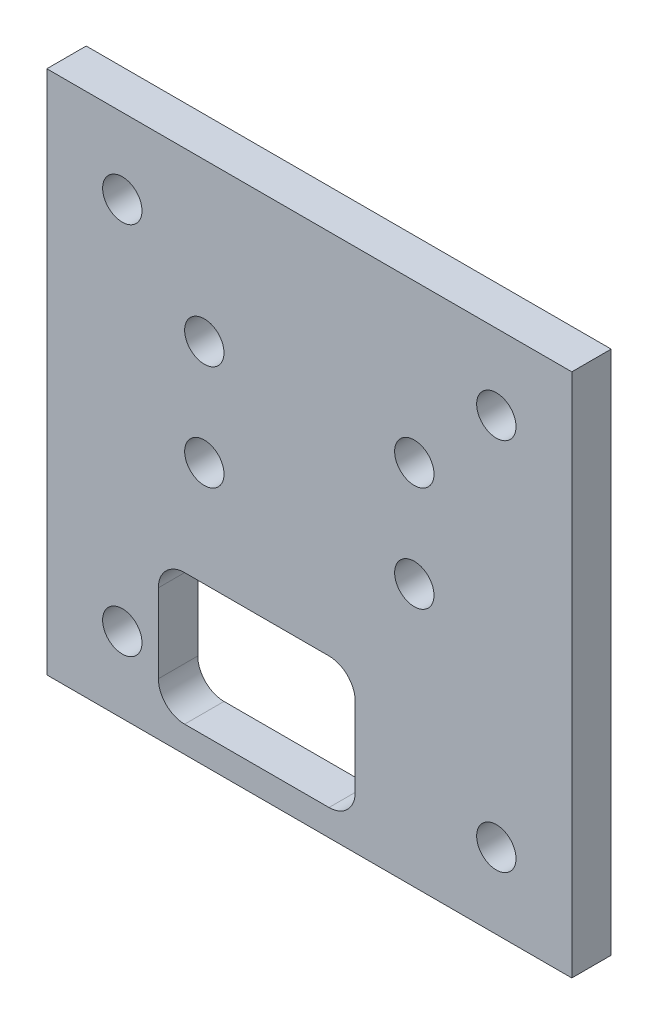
SolidWorks part; units mm, degrees
ref_plane "前视基准面" through (0, 0, 0) normal (0, 0, 1) x (1, 0, 0)
ref_plane "上视基准面" through (0, 0, 0) normal (0, 1, 0) x (1, 0, 0)
ref_plane "右视基准面" through (0, 0, 0) normal (1, 0, 0) x (0, 0, -1)
sketch "草图1" plane through (0, 0, 0) normal (0, 0, 1) x (1, 0, 0)
  line L1 (-20, 20) -> (20, 20)
  line L2 (-20, 20) -> (-20, -20)
  line L3 (-20, -20) -> (20, -20)
  line L4 (20, 20) -> (20, -20)
  line L5 (-20, 20) -> (20, -20) construction
  line L6 (-20, -20) -> (20, 20) construction
  point P0 (0, 0)
  dimension "D1" = 40
  dimension "D2" = 40
extrude "凸台-拉伸1" add sketch "草图1" along normal blind 3
hole_wizard "Ø3.0 (3) 直径孔1" positions "草图2" profile "草图3" hole size "Ø3.0" standard "GB"
sketch "草图2" plane through (0, 0, 3) normal (0, 0, 1) x (1, 0, 0)
  point P0 (-14.25, 14.25)
  point P2 (14.25, 14.25)
  point P4 (14.25, -14.25)
  point P6 (-14.25, -14.25)
  dimension "D1" = 28.5
  dimension "D2" = 28.5
  dimension "D3" = 28.5
  dimension "D4" = 28.5
  dimension "D5" = 14.25
  dimension "D6" = 14.25
sketch "草图3" plane through (-14.25, 14.25, 3) normal (1, 0, 0) x (0, -1, 0)
  line L0 (0, 0) -> (0, 5.9013)
  line L1 (0, 5.9013) -> (1.5, 5)
  line L2 (1.5, 5) -> (1.5, 0)
  line L5 (1.5, 0) -> (0, 0)
  line L10 (0, 5.9013) -> (-1.5, 5) construction
  line L11 (0, -6.35) -> (0, 107.95) construction
  dimension "孔直径" = 3
  dimension "孔深度" = 5
  dimension "导头角度" = 118
sketch "草图4" plane through (0, 0, 3) normal (0, 0, 1) x (1, 0, 0)
  line L0 (-20, 20) -> (-20, -20) construction
  line L1 (-11.5, -8) -> (3.5, -8)
  line L2 (-11.5, -8) -> (-11.5, -18)
  line L3 (-11.5, -18) -> (3.5, -18)
  line L4 (3.5, -8) -> (3.5, -18)
  line L5 (-11.5, -8) -> (3.5, -18) construction
  line L6 (-11.5, -18) -> (3.5, -8) construction
  line L7 (-20, -20) -> (20, -20) construction
  point P0 (-4, -13)
  point P5 (-2.5334, -11.4423)
  dimension "D1" = 10
  dimension "D2" = 15
  dimension "D3" = 23.5
  dimension "D4" = 12
extrude "切除-拉伸1" cut sketch "草图4" against normal blind 3
fillet "圆角1" radius 2 4 edges at (-11.5, -18, 1.5) (3.5, -8, 1.5) (3.5, -18, 1.5) (-11.5, -8, 1.5)
hole_wizard "Ø3.0 (3) 直径孔2" positions "草图5" profile "草图6" hole size "Ø3.0" standard "GB"
sketch "草图5" plane through (0, 0, 3) normal (0, 0, 1) x (1, 0, 0)
  point P0 (-8, 8)
  point P2 (-8, 0)
  point P4 (8, 0)
  point P6 (8, 8)
  dimension "D1" = 16
  dimension "D2" = 16
  dimension "D3" = 8
  dimension "D4" = 8
  dimension "D5" = 8
  dimension "D6" = 8
  dimension "D7" = 8
  dimension "D8" = 8
sketch "草图6" plane through (-8, 8, 3) normal (1, 0, 0) x (0, -1, 0)
  line L0 (0, 0) -> (0, 3)
  line L1 (0, 3) -> (1.5, 3)
  line L2 (1.5, 3) -> (1.5, 0)
  line L5 (1.5, 0) -> (0, 0)
  line L11 (0, -6.35) -> (0, 107.95) construction
  dimension "通孔孔直径" = 3
  dimension "通孔孔深度" = 3
